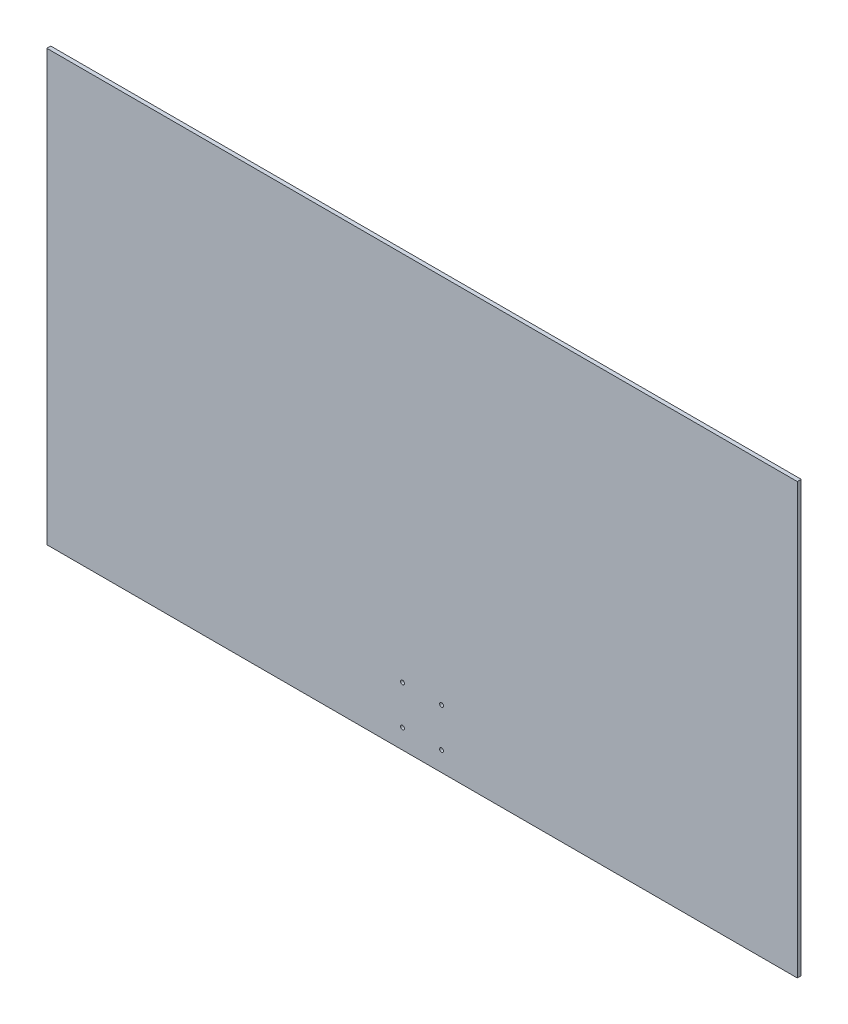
SolidWorks part; units mm, degrees
ref_plane "Plan de face" through (0, 0, 0) normal (0, 0, 1) x (1, 0, 0)
ref_plane "Plan de dessus" through (0, 0, 0) normal (0, 1, 0) x (1, 0, 0)
ref_plane "Plan de droite" through (0, 0, 0) normal (1, 0, 0) x (0, 0, -1)
sketch "Esquisse1" plane through (0, 0, 0) normal (0, 0, 1) x (1, 0, 0)
  line L0 (480, 550) -> (480, 0) construction
  line L1 (0, 0) -> (960, 0)
  line L2 (0, 0) -> (0, 550)
  line L3 (0, 550) -> (960, 550)
  line L4 (960, 0) -> (960, 550)
  line L5 (184.8879, 25) -> (261.0295, 25) construction
  line L6 (182.7389, 75) -> (284.2142, 75) construction
  circle A0 centre (455, 25) radius 2.5
  circle A1 centre (455, 75) radius 2.5
  circle A2 centre (505, 25) radius 2.5
  circle A3 centre (505, 75) radius 2.5
  dimension "D3" = 5
  dimension "D4" = 25
  dimension "D5" = 5
  dimension "D6" = 25
  dimension "D1" = 960
  dimension "D2" = 550
  dimension "D7" = 50
  dimension "D8" = 25
extrude "Boss.-Extru.1" add sketch "Esquisse1" along normal blind 5
